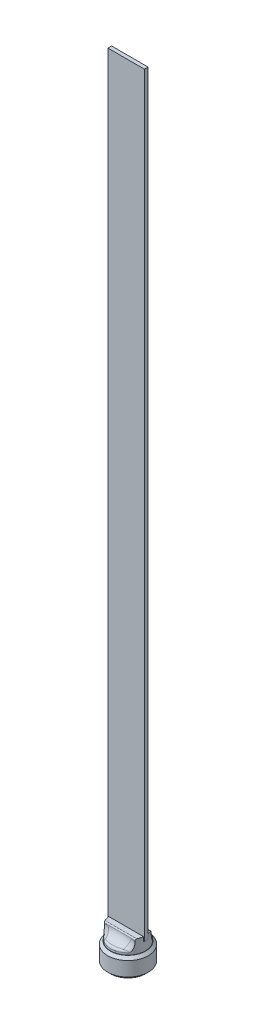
SolidWorks part; units mm, degrees
ref_plane "Front Plane" through (0, 0, 0) normal (0, 0, 1) x (1, 0, 0)
ref_plane "Top Plane" through (0, 0, 0) normal (0, 1, 0) x (1, 0, 0)
ref_plane "Right Plane" through (0, 0, 0) normal (1, 0, 0) x (0, 0, -1)
imported_body "Imported1"
sketch "Sketch1" plane through (0, 18.796, 0) normal (0, 1, 0) x (1, 0, 0)
  line L0 (-11.7773, 1.1811) -> (11.7773, 1.1811)
  line L1 (11.19, 1.1811) -> (-11.19, 1.1811) construction
  line L2 (-11.19, -1.1811) -> (11.19, -1.1811) construction
  line L3 (11.7773, -1.1811) -> (-11.7773, -1.1811)
  arc A0 (-11.7773, 1.1811) -> (-11.7773, -1.1811) centre (0, 0) ccw
  arc A1 (11.7773, -1.1811) -> (11.7773, 1.1811) centre (0, 0) ccw
  dimension "D1" = 23.6728
extrude "Boss-Extrude1" add sketch "Sketch1" along normal offset from surface (489.204 mm away) 508
